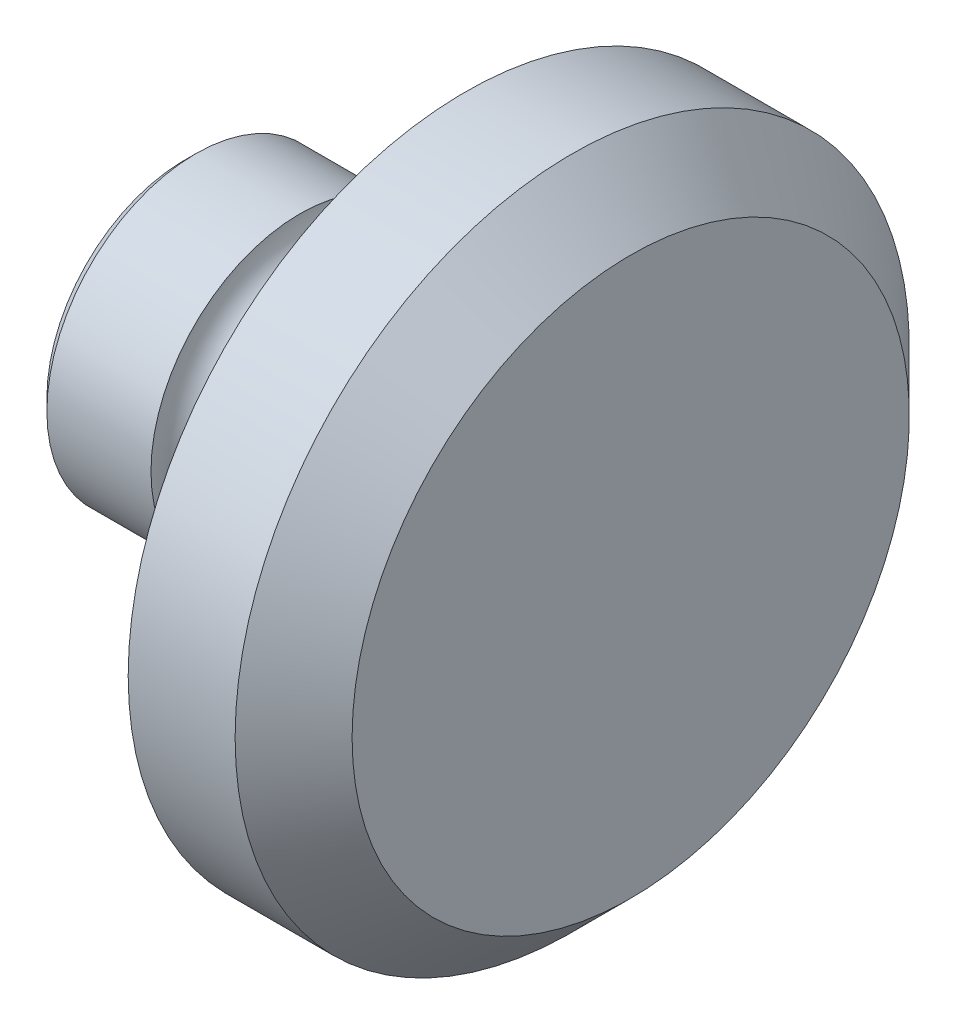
SolidWorks part; units mm, degrees
ref_plane "Front Plane" through (0, 0, 0) normal (0, 0, 1) x (1, 0, 0)
ref_plane "Top Plane" through (0, 0, 0) normal (0, 1, 0) x (1, 0, 0)
ref_plane "Right Plane" through (0, 0, 0) normal (1, 0, 0) x (0, 0, -1)
sketch "Sketch1" plane through (0, 0, 0) normal (0, 0, 1) x (1, 0, 0)
  line L0 (-26.421, 0) -> (38.191, 0) construction
  line L1 (-21.7574, 9) -> (-22.4645, 8.2929)
  line L2 (-21.7574, 9) -> (-15.4645, 9)
  line L3 (-11.4645, 9) -> (-5.4645, 9)
  line L4 (-5.4645, 9) -> (-5.4645, 20.3785)
  line L5 (-5.4645, 20.3785) -> (0.9999, 20.3785)
  line L6 (0.9999, 20.3785) -> (4.5355, 16.8429)
  line L7 (4.5355, 16.8429) -> (4.5355, 0)
  line L8 (-22.4645, 8.2929) -> (-22.4645, 0)
  line L9 (4.5355, 0) -> (-22.4645, 0)
  arc A0 (-15.4645, 9) -> (-11.4645, 9) centre (-13.4645, 9) ccw
  dimension "D1" = 2
  dimension "D2" = 10
  dimension "D3" = 10
  dimension "D4" = 1
  dimension "D5" = 135
  dimension "D6" = 16.8429
  dimension "D7" = 225
  dimension "D8" = 5
  dimension "D9" = 9
  dimension "D10" = 17
revolve "Revolve1" add sketch "Sketch1" angle 360 about L0
